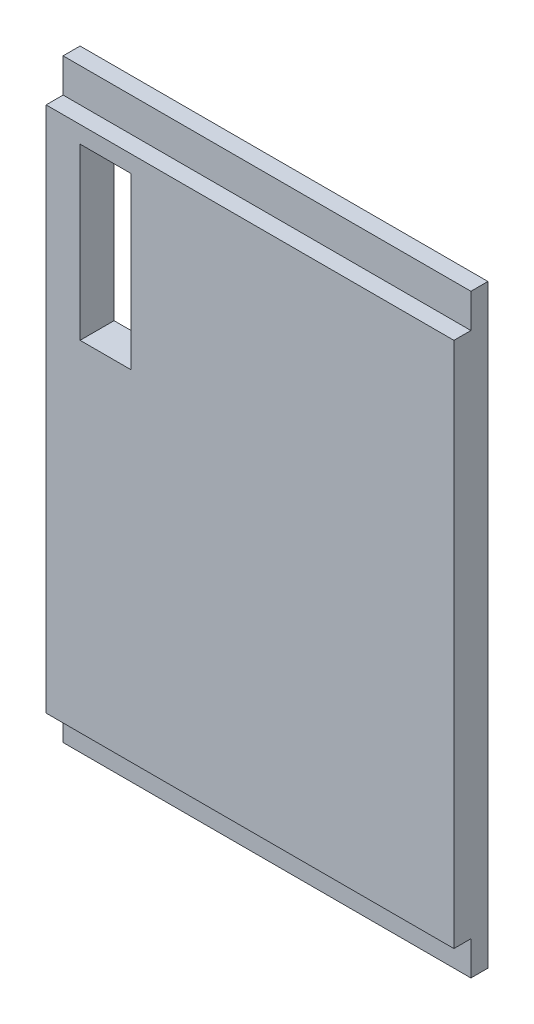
SolidWorks part; units mm, degrees
ref_plane "정면" through (0, 0, 0) normal (0, 0, 1) x (1, 0, 0)
ref_plane "윗면" through (0, 0, 0) normal (0, 1, 0) x (1, 0, 0)
ref_plane "우측면" through (0, 0, 0) normal (1, 0, 0) x (0, 0, -1)
sketch "스케치1" plane through (0, 0, 0) normal (0, 0, 1) x (1, 0, 0)
  line L1 (-12, -17.5) -> (12, -17.5)
  line L2 (-12, -17.5) -> (-12, 17.5)
  line L3 (-12, 17.5) -> (12, 17.5)
  line L4 (12, -17.5) -> (12, 17.5)
  line L5 (-12, -17.5) -> (12, 17.5) construction
  line L6 (-12, 17.5) -> (12, -17.5) construction
  point P0 (0, 0)
  dimension "D1" = 24
  dimension "D2" = 35
extrude "보스-돌출1" add sketch "스케치1" along normal blind 1
sketch "스케치2" plane through (0, 0, 1) normal (0, 0, 1) x (1, 0, 0)
  line L0 (12, -17.5) -> (12, 17.5) construction
  line L1 (-12, -15.5) -> (12, -15.5)
  line L2 (-12, -15.5) -> (-12, 15.5)
  line L3 (-12, 15.5) -> (12, 15.5)
  line L4 (12, -15.5) -> (12, 15.5)
  line L5 (-12, -15.5) -> (12, 15.5) construction
  line L6 (-12, 15.5) -> (12, -15.5) construction
  point P0 (0, 0)
  dimension "D1" = 31
extrude "보스-돌출2" add sketch "스케치2" along normal blind 1
sketch "스케치3" plane through (0, 0, 0) normal (0, 0, -1) x (-1, 0, 0)
  line L0 (-12, 17.5) -> (12, 17.5) construction
  line L1 (7, 14.5) -> (10, 14.5)
  line L2 (7, 14.5) -> (7, 4.5)
  line L3 (7, 4.5) -> (10, 4.5)
  line L4 (10, 14.5) -> (10, 4.5)
  line L5 (12, 17.5) -> (12, -17.5) construction
  dimension "D1" = 3
  dimension "D2" = 2
  dimension "D3" = 10
  dimension "D4" = 3
extrude "컷-돌출1" cut sketch "스케치3" against normal through all
